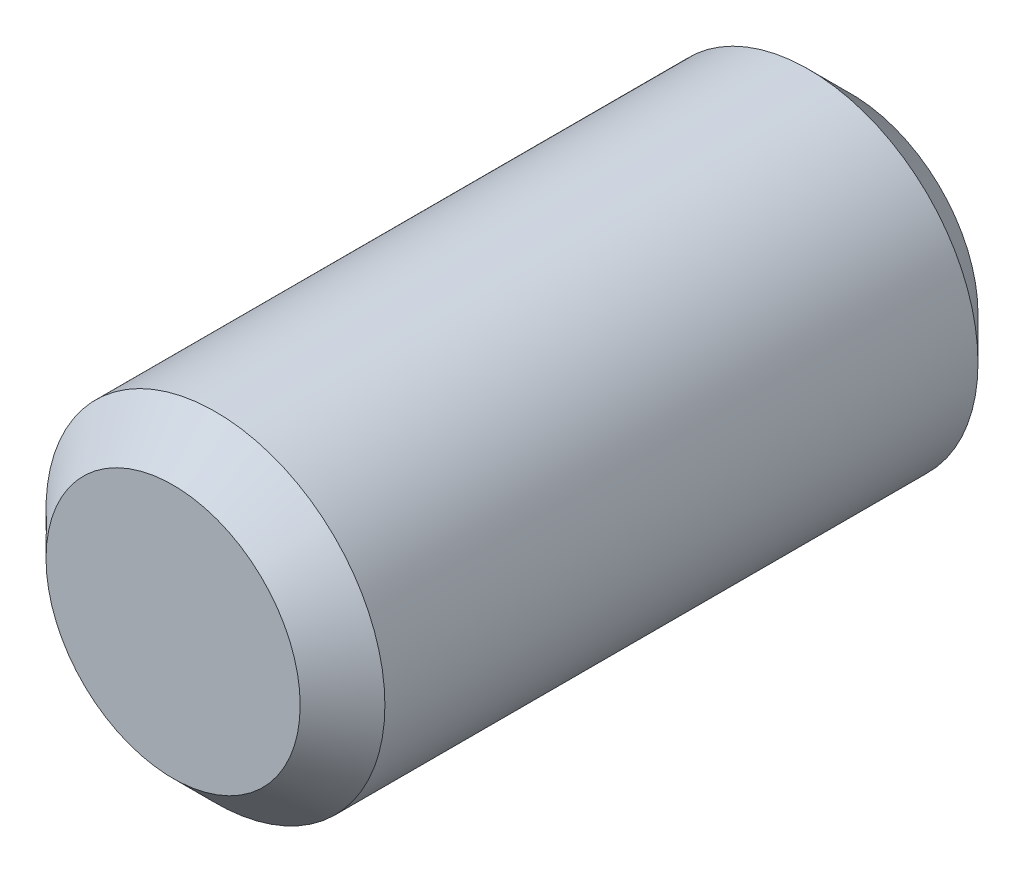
SolidWorks part; units mm, degrees
ref_plane "Face" through (0, 0, 0) normal (0, 0, 1) x (1, 0, 0)
ref_plane "Dessus" through (0, 0, 0) normal (0, 1, 0) x (1, 0, 0)
ref_plane "Droite" through (0, 0, 0) normal (1, 0, 0) x (0, 0, -1)
sketch "Esquisse1" plane through (0, 0, 0) normal (0, 0, 1) x (1, 0, 0)
  circle A0 centre (0, 0) radius 2
extrude "Boss.-Extru.1" add sketch "Esquisse1" along normal mid plane 8
chamfer "Chanfrein1" distance 0.5 angle 45 2 edges at (2, 0, -4) (2, 0, 4)
